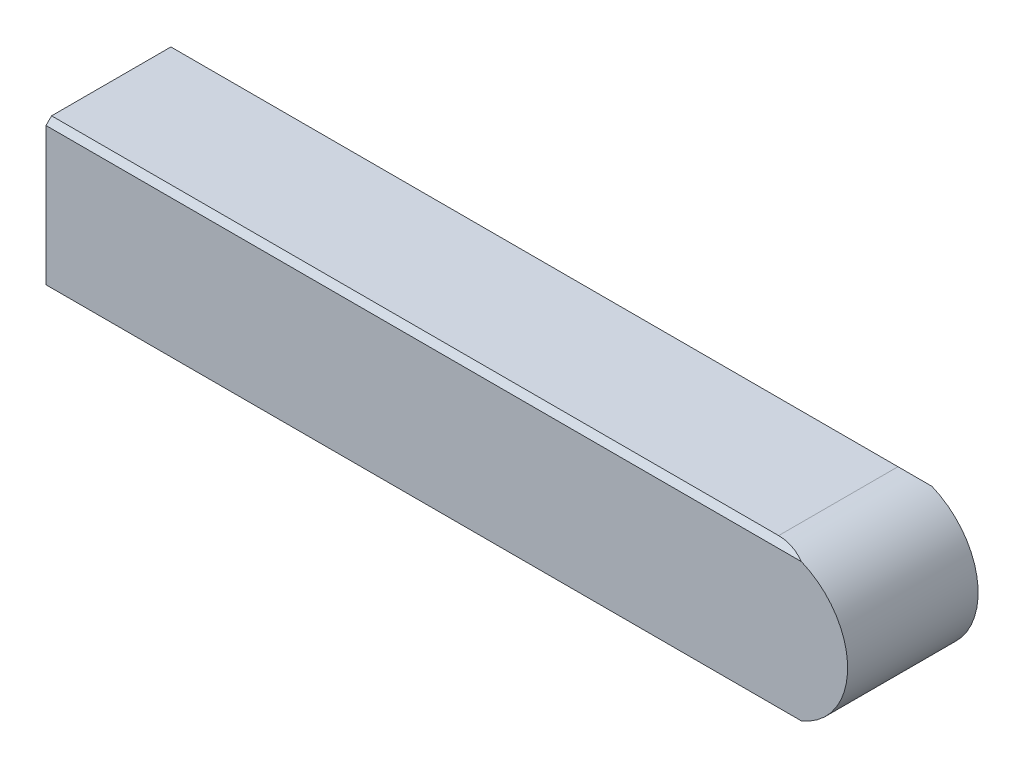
SolidWorks part; units mm, degrees
ref_plane "Front X-Y" through (0, 0, 0) normal (0, 0, 1) x (1, 0, 0)
ref_plane "Top X-Z" through (0, 0, 0) normal (0, 1, 0) x (1, 0, 0)
ref_plane "Right Y-Z" through (0, 0, 0) normal (1, 0, 0) x (0, 0, -1)
ref_plane "Plane1" through (0, 0, 0) normal (0, 0, 1) x (1, 0, 0)
sketch "Sketch1" plane through (0, 0, 0) normal (0, 0, 1) x (1, 0, 0)
  line L0 (0, 0) -> (39, 0)
  line L1 (39, 8) -> (0, 8)
  line L2 (0, 8) -> (0, 0)
  arc A0 (39, 0) -> (43, 4) centre (39, 4) ccw
  arc A1 (43, 4) -> (39, 8) centre (39, 4) ccw
extrude "Boss-Extrude1" add sketch "Sketch1" along normal blind 7
ref_plane "Plane2" through (0, 0, 0) normal (1, 0, 0) x (0, 0, -1)
sketch "Sketch2" plane through (0, 0, 0) normal (1, 0, 0) x (0, 0, -1)
  line L0 (-10.5, 12) -> (-10.5, -4)
  line L1 (-10.5, -4) -> (3.5, -4)
  line L2 (3.5, -4) -> (3.5, 12)
  line L3 (3.5, 12) -> (-10.5, 12)
  line L4 (-7, 0.3) -> (-6.7, 0)
  line L5 (-6.7, 0) -> (-0.3, 0)
  line L6 (-0.3, 0) -> (0, 0.3)
  line L7 (0, 0.3) -> (0, 7.7)
  line L8 (0, 7.7) -> (-0.3, 8)
  line L9 (-0.3, 8) -> (-6.7, 8)
  line L10 (-6.7, 8) -> (-7, 7.7)
  line L11 (-7, 7.7) -> (-7, 0.3)
extrude "Cut-Extrude1" cut sketch "Sketch2" along normal blind 43
